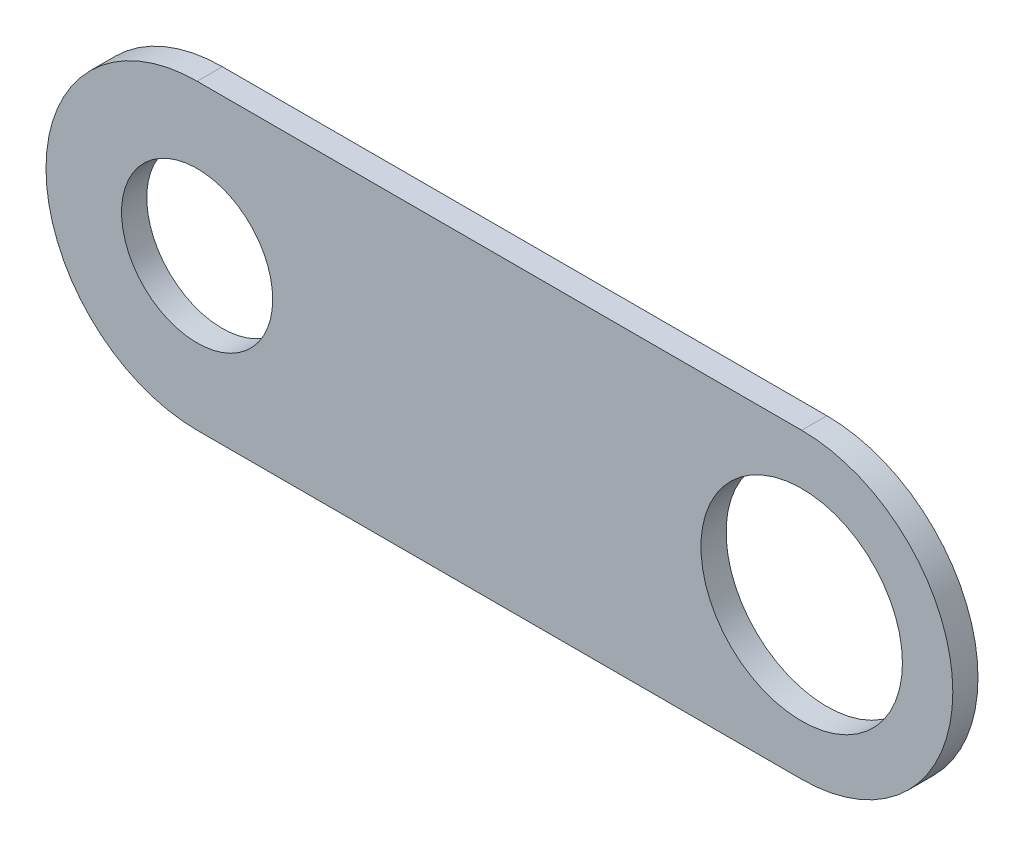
SolidWorks part; units mm, degrees
ref_plane "Front Plane" through (0, 0, 0) normal (0, 0, 1) x (1, 0, 0)
ref_plane "Top Plane" through (0, 0, 0) normal (0, 1, 0) x (1, 0, 0)
ref_plane "Right Plane" through (0, 0, 0) normal (1, 0, 0) x (0, 0, -1)
sketch "Sketch1" plane through (0, 0, 0) normal (0, 0, 1) x (1, 0, 0)
  line L0 (0, 0) -> (76.2, 0)
  line L1 (0, -38.1) -> (76.2, -38.1)
  arc A0 (0, 0) -> (0, -38.1) centre (0, -19.05) ccw
  arc A1 (76.2, -38.1) -> (76.2, 0) centre (76.2, -19.05) ccw
  circle A2 centre (0, -19.05) radius 9.525
  circle A3 centre (76.2, -19.05) radius 12.7
extrude "Boss-Extrude1" add sketch "Sketch1" along normal mid plane 3.175
equation "\"Width\"= 1.500in"
equation "\"CenterSpacing\"= 3.000in"
equation "\"T\" = 0.1250in"
equation "\"BracketHole\"= 0.750in"
equation "\"OtherHole\"= 1.000in"
equation "\"Length\"= \"CenterSpacing\" + \"Width\""
equation "\"EndOffset\"= \"Width\" / 2"
equation "\"D3@Sketch1\"=\"Width\""
equation "\"D1@Sketch1\"=\"CenterSpacing\""
equation "\"D2@Sketch1\"=\"BracketHole\""
equation "\"D4@Sketch1\"=\"OtherHole\""
equation "\"D1@Boss-Extrude1\"=\"T\""
